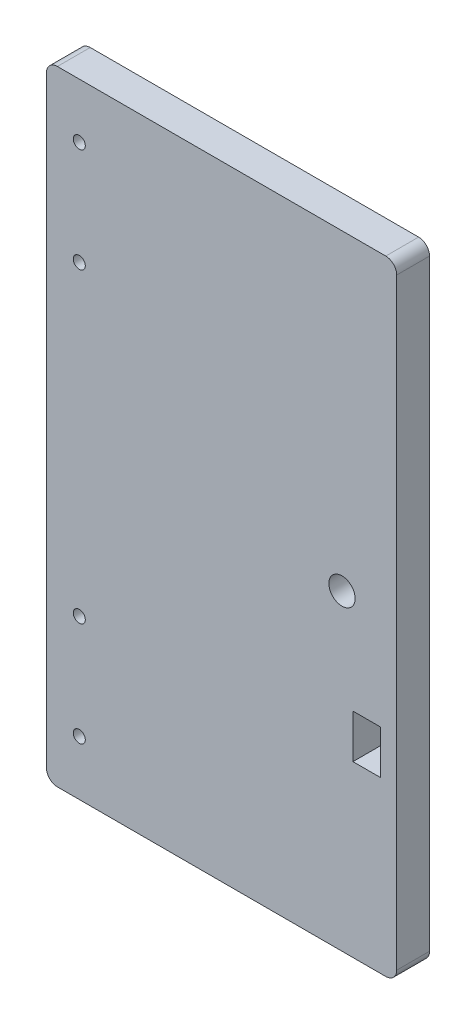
SolidWorks part; units mm, degrees
ref_plane "Plan de face" through (0, 0, 0) normal (0, 0, 1) x (1, 0, 0)
ref_plane "Plan de dessus" through (0, 0, 0) normal (0, 1, 0) x (1, 0, 0)
ref_plane "Plan de droite" through (0, 0, 0) normal (1, 0, 0) x (0, 0, -1)
sketch "Esquisse1" plane through (0, 0, 0) normal (0, 0, 1) x (1, 0, 0)
  line L1 (2, 0) -> (62, 0)
  line L2 (0, 2) -> (0, 112)
  line L3 (2, 114) -> (62, 114)
  line L4 (64, 2) -> (64, 112)
  arc A0 (2, 114) -> (0, 112) centre (2, 112) ccw
  arc A1 (2, 0) -> (0, 2) centre (2, 2) cw
  arc A2 (64, 2) -> (62, 0) centre (62, 2) cw
  arc A3 (62, 114) -> (64, 112) centre (62, 112) cw
  point P7 (0, 114)
  point P10 (0, 0)
  point P13 (64, 0)
  dimension "D3" = 2
  dimension "D1" = 114
  dimension "D2" = 64
extrude "Extrusion1" add sketch "Esquisse1" along normal blind 6
sketch "Esquisse2" plane through (0, 0, 6) normal (0, 0, 1) x (1, 0, 0)
  line L0 (0, 57) -> (64, 57) construction
  line L1 (0, 112) -> (0, 2) construction
  line L2 (64, 2) -> (64, 112) construction
  line L3 (6, 114) -> (6, 0) construction
  line L4 (62, 114) -> (2, 114) construction
  line L5 (2, 0) -> (62, 0) construction
  line L7 (49.5855, 35) -> (64, 35) construction
  line L8 (56, 39) -> (61, 39)
  line L9 (56, 39) -> (56, 31)
  line L10 (56, 31) -> (61, 31)
  line L11 (61, 39) -> (61, 31)
  circle A0 centre (54, 57) radius 2.4
  circle A1 centre (6, 104) radius 1.1
  circle A2 centre (6, 85) radius 1.1
  circle A3 centre (6, 29) radius 1.1
  circle A4 centre (6, 10) radius 1.1
  dimension "D1" = 4.8
  dimension "D5" = 19
  dimension "D6" = 2.2
  dimension "D2" = 10
  dimension "D3" = 6
  dimension "D4" = 10
  dimension "D7" = 35
  dimension "D8" = 5
  dimension "D9" = 3
  dimension "D10" = 8
extrude "Enlèv. mat.-Extru.1" cut sketch "Esquisse2" against normal through all
